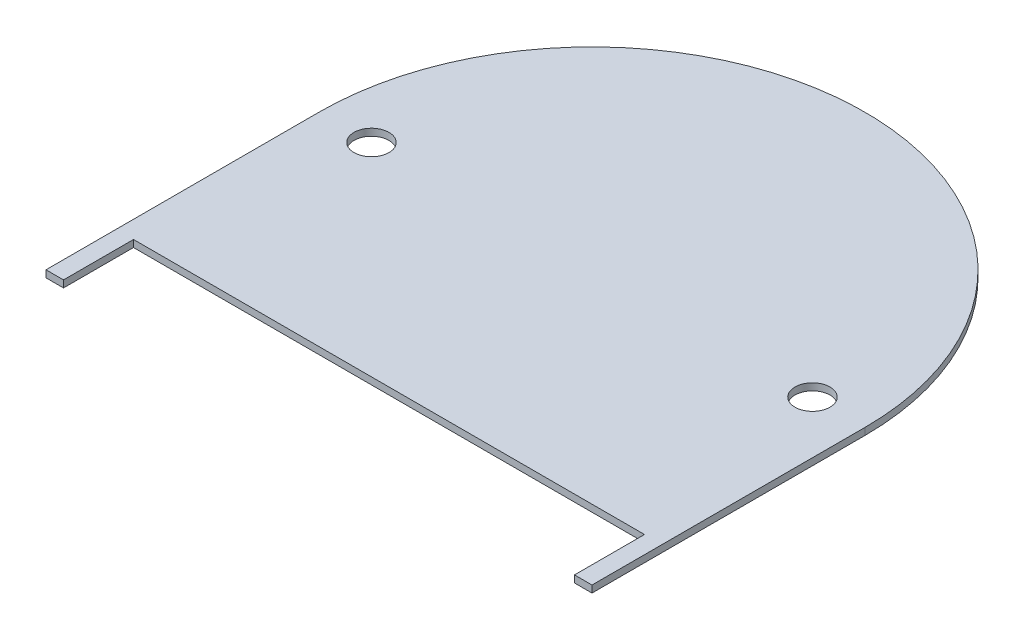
SolidWorks part; units mm, degrees
ref_plane "Front Plane" through (0, 0, 0) normal (0, 0, 1) x (1, 0, 0)
ref_plane "Top Plane" through (0, 0, 0) normal (0, 1, 0) x (1, 0, 0)
ref_plane "Right Plane" through (0, 0, 0) normal (1, 0, 0) x (0, 0, -1)
sketch "Sketch1" plane through (0, 0, 0) normal (0, 1, 0) x (1, 0, 0)
  line L1 (-99.06, 0) -> (99.06, 0)
  line L2 (-99.06, 0) -> (-99.06, -99.06)
  line L3 (-99.06, -99.06) -> (99.06, -99.06)
  line L4 (99.06, 0) -> (99.06, -99.06)
  circle A0 centre (0, 0) radius 99.06
  dimension "D1" = 198.12
extrude "Boss-Extrude1" add sketch "Sketch1" along normal blind 2.54 contours L1 A0 | A0 L1 | A0 L2 L3 | A0 L3 L4
sketch "Sketch2" plane through (0, 2.54, 0) normal (0, 1, 0) x (1, 0, 0)
  line L0 (0, -99.06) -> (0, 99.06) construction
  line L1 (-99.06, -99.06) -> (99.06, -99.06) construction
  line L2 (0, 0) -> (-38.4948, -22.225) construction
  line L3 (0, 0) -> (38.4948, -22.225) construction
  line L4 (0, 0) -> (-80.01, 0) construction
  line L5 (0, 0) -> (80.01, 0) construction
  line L6 (-99.06, 0) -> (-99.06, -99.06) construction
  line L8 (92.71, -73.66) -> (-92.71, -73.66)
  line L9 (92.71, -73.66) -> (92.71, -99.06)
  line L10 (92.71, -99.06) -> (-92.71, -99.06)
  line L11 (-92.71, -73.66) -> (-92.71, -99.06)
  line L12 (92.71, -73.66) -> (-92.71, -99.06) construction
  line L13 (92.71, -99.06) -> (-92.71, -73.66) construction
  arc A0 (99.06, 0) -> (-99.06, 0) centre (0, 0) ccw construction
  circle A5 centre (-80.01, 0) radius 6.35
  circle A6 centre (80.01, 0) radius 6.35
  point P8 (0, -86.36)
  dimension "D1" = 6.35
  dimension "D7" = 12.7
  dimension "D2" = 120
  dimension "D3" = 120
  dimension "D4" = 44.45
  dimension "D5" = 25.4
  dimension "D6" = 19.05
extrude "Cut-Extrude1" cut sketch "Sketch2" against normal through all
